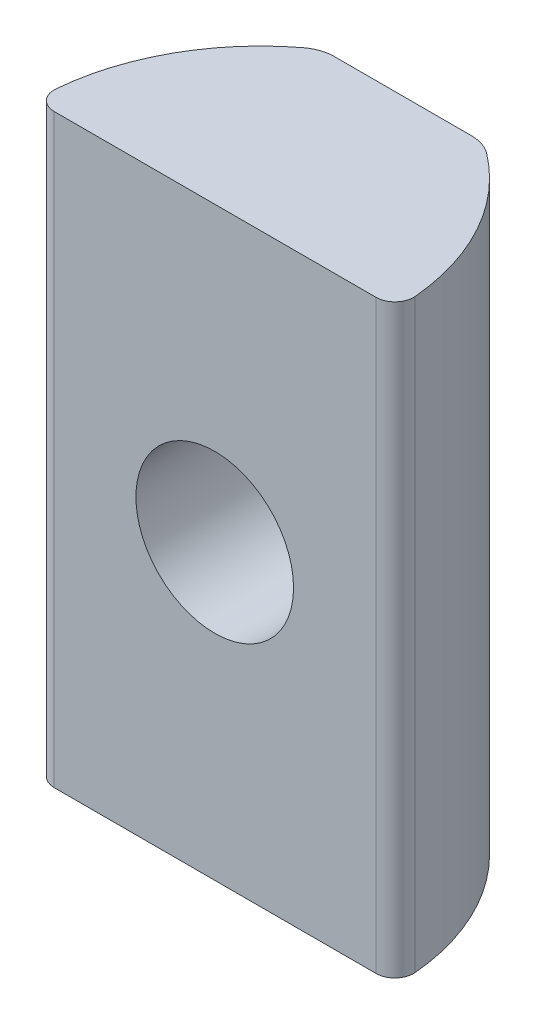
SolidWorks part; units mm, degrees
ref_plane "正面" through (0, 0, 0) normal (0, 0, 1) x (1, 0, 0)
ref_plane "平面" through (0, 0, 0) normal (0, 1, 0) x (1, 0, 0)
ref_plane "右側面" through (0, 0, 0) normal (1, 0, 0) x (0, 0, -1)
sketch "ｽｹｯﾁ1" plane through (0, 0, 0) normal (0, -1, 0) x (1, 0, 0)
  line L8 (-4.2884, 0) -> (4.2884, 0)
  line L9 (1.8306, -5) -> (-1.8306, -5)
  arc A8 (-4.7865, -0.544) -> (-2.4348, -4.7969) centre (1.1902, -0.0157) ccw
  arc A9 (-2.4348, -4.7969) -> (-1.8306, -5) centre (-1.8306, -4) ccw
  arc A10 (-4.2884, 0) -> (-4.7865, -0.544) centre (-4.2884, -0.5) ccw
  arc A11 (2.4348, -4.7969) -> (4.7865, -0.544) centre (-1.1902, -0.0157) ccw
  arc A12 (1.8306, -5) -> (2.4348, -4.7969) centre (1.8306, -4) ccw
  arc A13 (4.7865, -0.544) -> (4.2884, 0) centre (4.2884, -0.5) ccw
extrude "押し出し1" add sketch "ｽｹｯﾁ1" along normal mid plane 15.6
hole_wizard "M5x0.8 ねじ穴1" positions "ｽｹｯﾁ3" profile "ｽｹｯﾁ2" tap size "M5x0.8" standard "JIS"
sketch "ｽｹｯﾁ3" plane through (1.3374, 5.2145, 0) normal (0, 0, 1) x (1, 0, 0)
  line L1 (2.951, -13.0145) -> (-5.6258, -13.0145) construction
  line L3 (2.951, -13.0145) -> (2.951, 2.5855) construction
  point P0 (-1.349, -5.2145)
  dimension "D1" = 7.8
  dimension "D2" = 4.3
sketch "ｽｹｯﾁ2" plane through (-0.0116, 0, 0) normal (1, 0, 0) x (0, -1, 0)
  line L0 (0, 0) -> (0, 5)
  line L1 (0, 5) -> (2.1, 5)
  line L2 (2.1, 5) -> (2.1, 0)
  line L5 (2.1, 0) -> (0, 0)
  line L11 (0, -6.35) -> (0, 107.95) construction
  dimension "通孔螺纹孔钻头直径" = 4.2
  dimension "通孔螺纹孔钻头深度" = 5
